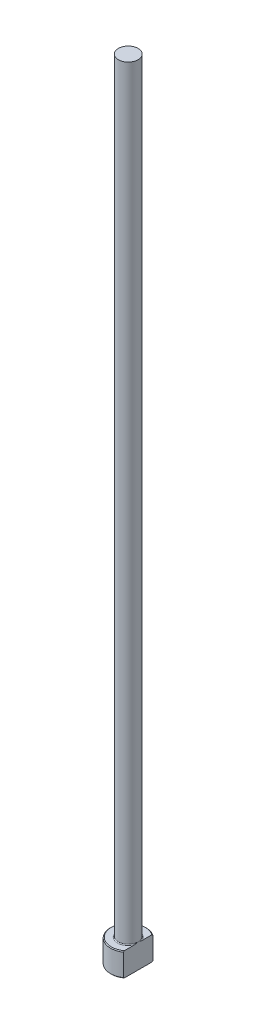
SolidWorks part; units mm, degrees
ref_plane "Front Plane" through (0, 0, 0) normal (0, 0, 1) x (1, 0, 0)
ref_plane "Top Plane" through (0, 0, 0) normal (0, 1, 0) x (1, 0, 0)
ref_plane "Right Plane" through (0, 0, 0) normal (1, 0, 0) x (0, 0, -1)
sketch "Sketch1" plane through (0, 0, 0) normal (0, 0, 1) x (1, 0, 0)
  line L0 (0, 259.9588) -> (0, -15.1925) construction
  line L1 (0, 0) -> (-4.5, 0)
  line L2 (-4.5, 0) -> (-4.5, 6)
  line L3 (-4.5, 6) -> (-2.5, 6)
  line L4 (-2.5, 6) -> (-2.5, 200)
  line L5 (-2.5, 200) -> (0, 200)
  line L6 (0, 200) -> (0, 0)
  dimension "L" = 200
  dimension "H" = 9
  dimension "T" = 6
  dimension "D" = 5
revolve "Revolve1" add sketch "Sketch1" angle 360 about L0
chamfer "Chamfer1" distance 0.2 angle 45 2 edges at (0, 6, 4.5) (0, 0, 4.5)
fillet "Fillet1" radius 0.2 1 edges at (0, 6, 2.5)
sketch "Sketch2" plane through (0, 0, 0) normal (0, 1, 0) x (1, 0, 0)
  line L0 (2.5, -3.7417) -> (2.5, 3.7417)
  circle A0 centre (0, 0) radius 4.5 construction
  arc A1 (2.5, -3.7417) -> (2.5, 3.7417) centre (0, 0) ccw
  circle A2 centre (0, 0) radius 2.5 construction
extrude "KEYED HEAD" cut sketch "Sketch2" along normal through all
